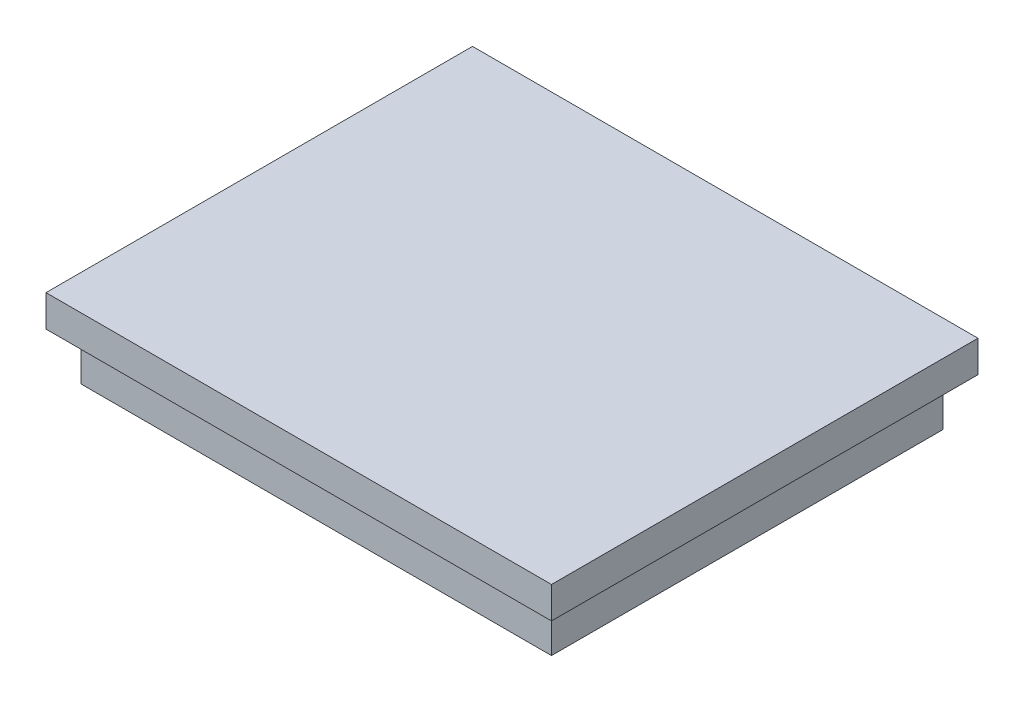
SolidWorks part; units mm, degrees
ref_plane "Спереди" through (0, 0, 0) normal (0, 0, 1) x (1, 0, 0)
ref_plane "Сверху" through (0, 0, 0) normal (0, 1, 0) x (1, 0, 0)
ref_plane "Справа" through (0, 0, 0) normal (1, 0, 0) x (0, 0, -1)
sketch "Sketch1" plane through (0, 0, 0) normal (0, 1, 0) x (1, 0, 0)
  line L1 (14.9, -12.4) -> (-14.9, -12.4)
  line L2 (14.9, -12.4) -> (14.9, 12.4)
  line L3 (14.9, 12.4) -> (-14.9, 12.4)
  line L4 (-14.9, -12.4) -> (-14.9, 12.4)
  line L5 (14.9, -12.4) -> (-14.9, 12.4) construction
  line L6 (14.9, 12.4) -> (-14.9, -12.4) construction
  point P0 (0, 0)
  dimension "D1" = 29.8
  dimension "D2" = 24.8
extrude "Boss-Extrude1" add sketch "Sketch1" along normal blind 3
sketch "Sketch2" plane through (0, 3, 0) normal (0, 1, 0) x (1, 0, 0)
  line L0 (-14.9, 12.4) -> (14.9, -12.4) construction
  line L1 (0, 13.5) -> (0, -13.5) construction
  line L2 (16, -13.5) -> (-16, -13.5)
  line L3 (16, -13.5) -> (16, 13.5)
  line L4 (16, 13.5) -> (-16, 13.5)
  line L5 (-16, -13.5) -> (-16, 13.5)
  line L6 (16, -13.5) -> (-16, 13.5) construction
  line L7 (16, 13.5) -> (-16, -13.5) construction
  point P4 (0, 0)
  dimension "D1" = 32
  dimension "D2" = 27
extrude "Boss-Extrude2" add sketch "Sketch2" along normal blind 2
